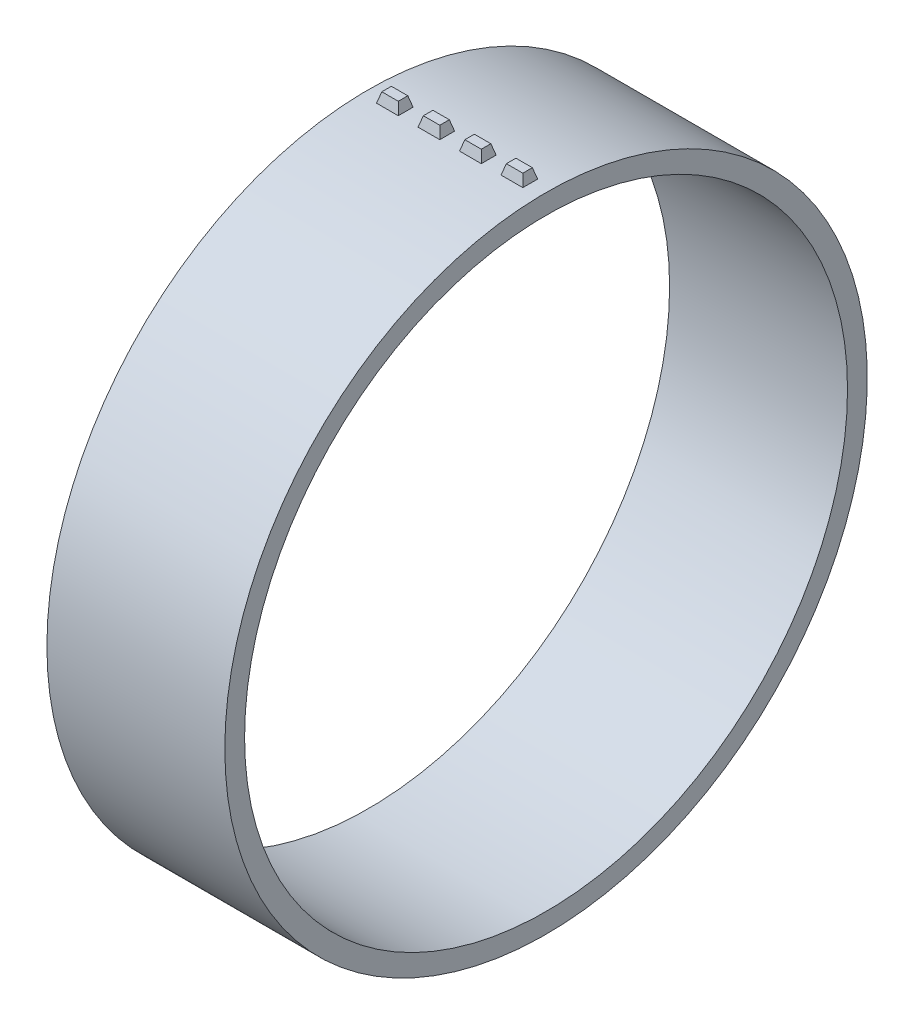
SolidWorks part; units mm, degrees
ref_plane "Ebene vorne" through (0, 0, 0) normal (0, 0, 1) x (1, 0, 0)
ref_plane "Ebene oben" through (0, 0, 0) normal (0, 1, 0) x (1, 0, 0)
ref_plane "Ebene rechts" through (0, 0, 0) normal (1, 0, 0) x (0, 0, -1)
sketch "Skizze1" plane through (0, 0, 0) normal (0, 0, 1) x (1, 0, 0)
  line L0 (0, 0) -> (0, 325) construction
  line L2 (0, 0) -> (149.6315, 0) construction
  line L3 (-90, 325) -> (90, 325)
  line L4 (-90, 325) -> (-90, 305)
  line L5 (-90, 305) -> (90, 305)
  line L6 (90, 325) -> (90, 305)
  dimension "D2" = 180
  dimension "D1" = 650
  dimension "D3" = 20
revolve "Rotation1" add sketch "Skizze1" angle 360 about L2
ref_plane "Ebene1" through (0, 325, 0) normal (0, 1, 0) x (-1, 0, 0)
sketch "Skizze2" plane through (0, 325, 0) normal (0, 1, 0) x (1, 0, 0)
  line L0 (0, 0) -> (0, 110.1881) construction
  line L1 (-52, -7.5) -> (-32, -7.5) construction
  line L2 (-74, 7.5) -> (-52, 7.5)
  line L3 (-74, 7.5) -> (-74, -7.5)
  line L4 (-74, -7.5) -> (-52, -7.5)
  line L5 (-52, 7.5) -> (-52, -7.5)
  line L6 (-32, 7.5) -> (-10, 7.5)
  line L7 (-32, 7.5) -> (-32, -7.5)
  line L8 (-32, -7.5) -> (-10, -7.5)
  line L9 (-10, 7.5) -> (-10, -7.5)
  line L10 (52, -7.5) -> (32, -7.5) construction
  line L11 (10, 7.5) -> (10, -7.5)
  line L12 (32, -7.5) -> (10, -7.5)
  line L13 (32, 7.5) -> (32, -7.5)
  line L14 (32, 7.5) -> (10, 7.5)
  line L15 (52, 7.5) -> (52, -7.5)
  line L16 (74, -7.5) -> (52, -7.5)
  line L17 (74, 7.5) -> (74, -7.5)
  line L18 (74, 7.5) -> (52, 7.5)
  line L19 (-10, -7.5) -> (10, -7.5) construction
  line L20 (-74, 0) -> (-10, 0) construction
  dimension "D1" = 22
  dimension "D2" = 15
  dimension "D3" = 20
extrude "Linear austragen1" add sketch "Skizze2" along normal blind 10 draft 15
pattern_circular "Kreismuster4" [suppressed] count 70 over 360
equation "\"LÄNGE\"=0"
equation "\"BREITE\"=0"
equation "\"HÖHE\"=0"
equation "\"DURCHMESSER\"=0"
equation "\"Stückzahl\"= 1"
